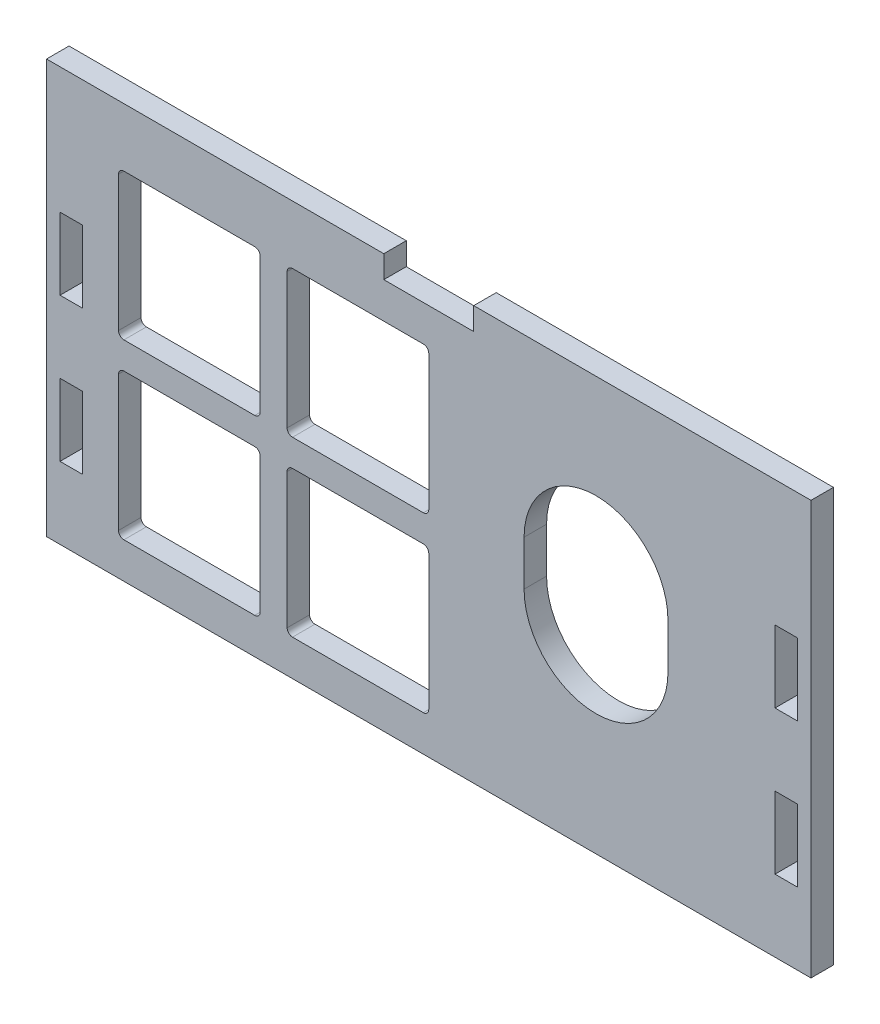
SolidWorks part; units mm, degrees
ref_plane "前视基准面" through (0, 0, 0) normal (0, 0, 1) x (1, 0, 0)
ref_plane "上视基准面" through (0, 0, 0) normal (0, 1, 0) x (1, 0, 0)
ref_plane "右视基准面" through (0, 0, 0) normal (1, 0, 0) x (0, 0, -1)
sketch "草图1" plane through (0, 0, 0) normal (0, 0, 1) x (1, 0, 0)
  line L1 (-42.5, 0) -> (42.5, 0)
  line L2 (-42.5, 0) -> (-42.5, 46)
  line L3 (-42.5, 46) -> (42.5, 46)
  line L4 (42.5, 0) -> (42.5, 46)
  dimension "D1" = 85
  dimension "D2" = 46
extrude "凸台-拉伸1" add sketch "草图1" along normal blind 2.5
sketch "草图2" plane through (0, 0, 2.5) normal (0, 0, 1) x (1, 0, 0)
  line L0 (0, 0) -> (0, 40.8847) construction
  line L1 (-42.5, 0) -> (42.5, 0) construction
  line L2 (42.5, 0) -> (42.5, 46) construction
  line L3 (38.5, 32) -> (41, 32)
  line L4 (38.5, 32) -> (38.5, 24)
  line L5 (38.5, 24) -> (41, 24)
  line L6 (41, 32) -> (41, 24)
  line L7 (38.5, 16) -> (41, 16)
  line L8 (38.5, 16) -> (38.5, 8)
  line L9 (38.5, 8) -> (41, 8)
  line L10 (41, 16) -> (41, 8)
  line L11 (-41, 16) -> (-41, 8)
  line L12 (-38.5, 8) -> (-41, 8)
  line L13 (-38.5, 16) -> (-38.5, 8)
  line L14 (-38.5, 16) -> (-41, 16)
  line L15 (-41, 32) -> (-41, 24)
  line L16 (-38.5, 24) -> (-41, 24)
  line L17 (-38.5, 32) -> (-38.5, 24)
  line L18 (-38.5, 32) -> (-41, 32)
  dimension "D1" = 2.5
  dimension "D2" = 1.5
  dimension "D3" = 8
  dimension "D4" = 8
  dimension "D5" = 8
  dimension "D6" = 8
extrude "切除-拉伸1" cut sketch "草图2" against normal up to surface (2.5 mm away)
sketch "草图3" plane through (0, 0, 2.5) normal (0, 0, 1) x (1, 0, 0)
  line L0 (18.6, 26.5) -> (18.6, 21.5) construction
  line L1 (26.6, 26.5) -> (26.6, 21.5)
  line L2 (10.6, 26.5) -> (10.6, 21.5)
  line L3 (-42.5, 0) -> (42.5, 0) construction
  arc A0 (26.6, 26.5) -> (10.6, 26.5) centre (18.6, 26.5) ccw
  arc A1 (10.6, 21.5) -> (26.6, 21.5) centre (18.6, 21.5) ccw
  point P2 (18.6, 24)
  dimension "D4" = 21.5
  dimension "D1" = 16
  dimension "D2" = 5
  dimension "D3" = 18.6
extrude "切除-拉伸2" cut sketch "草图3" against normal up to surface (2.5 mm away)
sketch "草图4" plane through (0, 0, 2.5) normal (0, 0, 1) x (1, 0, 0)
  line L0 (0, 0) -> (0, 46) construction
  line L1 (-42.5, 0) -> (42.5, 0) construction
  line L2 (42.5, 46) -> (-42.5, 46) construction
  line L4 (-5, 46) -> (5, 46)
  line L5 (-5, 46) -> (-5, 43.5)
  line L6 (-5, 43.5) -> (5, 43.5)
  line L7 (5, 46) -> (5, 43.5)
  dimension "D1" = 2.5
  dimension "D2" = 10
extrude "切除-拉伸3" cut sketch "草图4" against normal up to surface (2.5 mm away)
sketch "草图5" plane through (0, 0, 2.5) normal (0, 0, 1) x (1, 0, 0)
  line L0 (-38.5, 24) -> (-38.5, 32) construction
  line L1 (-34.5, 39.5) -> (0, 39.5) construction
  line L2 (-34.5, 39.5) -> (-34.5, 4) construction
  line L3 (-34.5, 4) -> (0, 4) construction
  line L4 (0, 39.5) -> (0, 4) construction
  line L5 (-5, 43.5) -> (5, 43.5) construction
  line L6 (-42.5, 0) -> (42.5, 0) construction
  line L7 (-34.5, 21.75) -> (0, 21.75) construction
  line L8 (-17.25, 39.5) -> (-17.25, 4) construction
  line L9 (-18.75, 38.9) -> (-18.75, 23.85)
  line L10 (-33.9, 4) -> (-19.35, 4)
  line L11 (-34.5, 4.6) -> (-34.5, 19.65)
  line L12 (-33.9, 20.25) -> (-19.35, 20.25)
  line L13 (-18.75, 4.6) -> (-18.75, 19.65)
  line L14 (-33.9, 23.25) -> (-19.35, 23.25)
  line L15 (-34.5, 38.9) -> (-34.5, 23.85)
  line L16 (-33.9, 39.5) -> (-19.35, 39.5)
  line L17 (0, 39.5) -> (0, 4) construction
  line L18 (-0.6, 39.5) -> (-15.15, 39.5)
  line L19 (0, 38.9) -> (0, 23.85)
  line L20 (-0.6, 23.25) -> (-15.15, 23.25)
  line L21 (-15.75, 4.6) -> (-15.75, 19.65)
  line L22 (-0.6, 20.25) -> (-15.15, 20.25)
  line L23 (0, 4.6) -> (0, 19.65)
  line L24 (-0.6, 4) -> (-15.15, 4)
  line L25 (-15.75, 38.9) -> (-15.75, 23.85)
  arc A0 (-34.5, 19.65) -> (-33.9, 20.25) centre (-33.9, 19.65) cw
  arc A1 (-18.75, 19.65) -> (-19.35, 20.25) centre (-19.35, 19.65) ccw
  arc A2 (-19.35, 4) -> (-18.75, 4.6) centre (-19.35, 4.6) ccw
  arc A3 (-34.5, 4.6) -> (-33.9, 4) centre (-33.9, 4.6) ccw
  arc A4 (-34.5, 38.9) -> (-33.9, 39.5) centre (-33.9, 38.9) cw
  arc A5 (-19.35, 39.5) -> (-18.75, 38.9) centre (-19.35, 38.9) cw
  arc A6 (-18.75, 23.85) -> (-19.35, 23.25) centre (-19.35, 23.85) cw
  arc A7 (-34.5, 23.85) -> (-33.9, 23.25) centre (-33.9, 23.85) ccw
  arc A8 (0, 23.85) -> (-0.6, 23.25) centre (-0.6, 23.85) cw
  arc A9 (-15.75, 23.85) -> (-15.15, 23.25) centre (-15.15, 23.85) ccw
  arc A10 (-15.15, 39.5) -> (-15.75, 38.9) centre (-15.15, 38.9) ccw
  arc A11 (0, 38.9) -> (-0.6, 39.5) centre (-0.6, 38.9) ccw
  arc A12 (0, 4.6) -> (-0.6, 4) centre (-0.6, 4.6) cw
  arc A13 (-15.15, 4) -> (-15.75, 4.6) centre (-15.15, 4.6) cw
  arc A14 (-15.75, 19.65) -> (-15.15, 20.25) centre (-15.15, 19.65) cw
  arc A15 (0, 19.65) -> (-0.6, 20.25) centre (-0.6, 19.65) ccw
  dimension "D4" = 0.6
  dimension "D5" = 0.6
  dimension "D6" = 0.6
  dimension "D7" = 0.6
  dimension "D1" = 4
  dimension "D2" = 4
  dimension "D3" = 4
  dimension "D8" = 3
  dimension "D9" = 3
extrude "切除-拉伸4" cut sketch "草图5" against normal up to surface (2.5 mm away)
